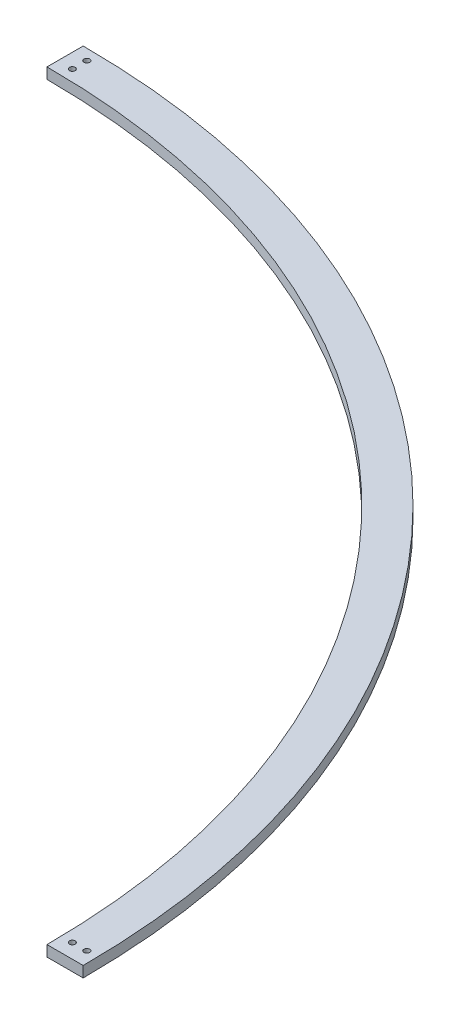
SolidWorks part; units mm, degrees
ref_plane "Front Plane" through (0, 0, 0) normal (0, 0, 1) x (1, 0, 0)
ref_plane "Top Plane" through (0, 0, 0) normal (0, 1, 0) x (1, 0, 0)
ref_plane "Right Plane" through (0, 0, 0) normal (1, 0, 0) x (0, 0, -1)
sketch "Sketch1" plane through (0, 0, 0) normal (0, 1, 0) x (1, 0, 0)
  line L0 (0, 220) -> (0, 210)
  line L1 (210, 0) -> (220, 0)
  line L2 (0, 315.2642) -> (0, -237.1001) construction
  line L3 (-143.3446, 0) -> (513.5023, 0) construction
  line L4 (215, 0) -> (215, 6.9808) construction
  line L5 (0, 215) -> (8.9843, 215) construction
  arc A0 (210, 0) -> (0, 210) centre (0, 0) ccw
  arc A1 (220, 0) -> (0, 220) centre (0, 0) ccw
  circle A2 centre (0, 0) radius 220 construction
  circle A3 centre (0, 0) radius 210 construction
  circle A4 centre (217, 4) radius 0.8
  circle A5 centre (213, 4) radius 0.8
  circle A6 centre (4, 217) radius 0.8
  circle A7 centre (4, 213) radius 0.8
  dimension "D1" = 10
  dimension "D2" = 420
  dimension "D3" = 1.6
  dimension "D6" = 1.6
  dimension "D4" = 4
  dimension "D5" = 2
  dimension "D7" = 4
  dimension "D8" = 2
extrude "Boss-Extrude1" add sketch "Sketch1" along normal blind 3
